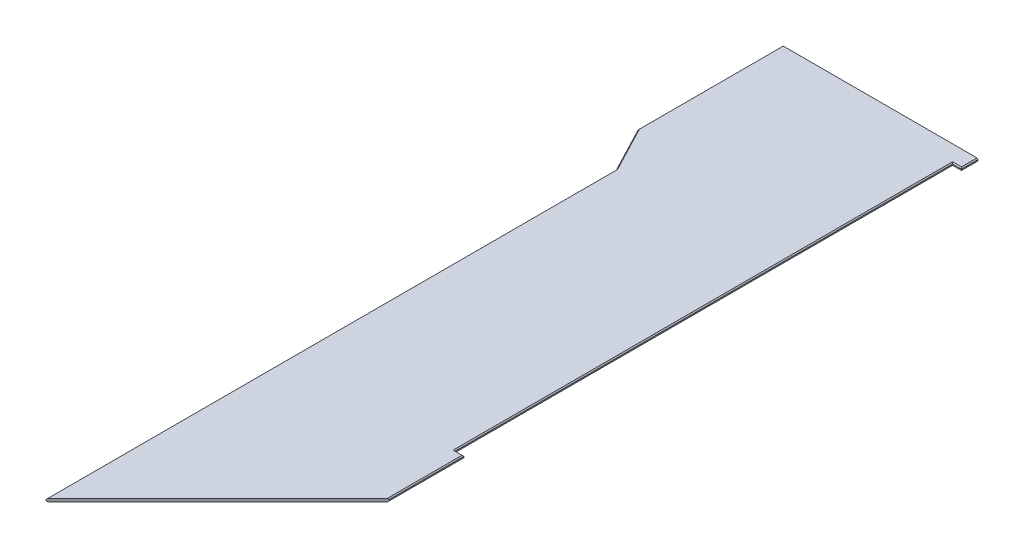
SolidWorks part; units mm, degrees
ref_plane "Front Plane" through (0, 0, 0) normal (1, 0, 0) x (0, 1, 0)
ref_plane "Top Plane" through (0, 0, 0) normal (0, 0, 1) x (0, 1, 0)
ref_plane "Right Plane" through (0, 0, 0) normal (0, 1, 0) x (-1, 0, 0)
sketch "Sketch2"
sketch_block_instance "Block4-1"
sketch_block "Block4" parameters "D1"=6, "D2"=6
extrude "Boss-Extrude2" add sketch "Sketch2" along normal mid plane 19.05
chamfer "Chamfer1" distance 6 angle 45 16 edges at (-487.0608, -9.525, 759.0185) (-559.6545, -9.525, -1106.1244) (-632.2483, -9.525, -1681.2829) (-487.0608, 9.525, 759.0185) (-559.6545, 9.525, -1106.1244) (-632.2483, 9.525, -1681.2829) (552.5517, -9.525, -2067.5462) (525.6517, -9.525, -2017.5462) (498.7517, -9.525, -511.5462) (525.6517, -9.525, 994.4538) (552.5517, -9.525, 1220.0538) (552.5517, 9.525, -2067.5462) (525.6517, 9.525, -2017.5462) (498.7517, 9.525, -511.5462) (525.6517, 9.525, 994.4538) (552.5517, 9.525, 1220.0538)
